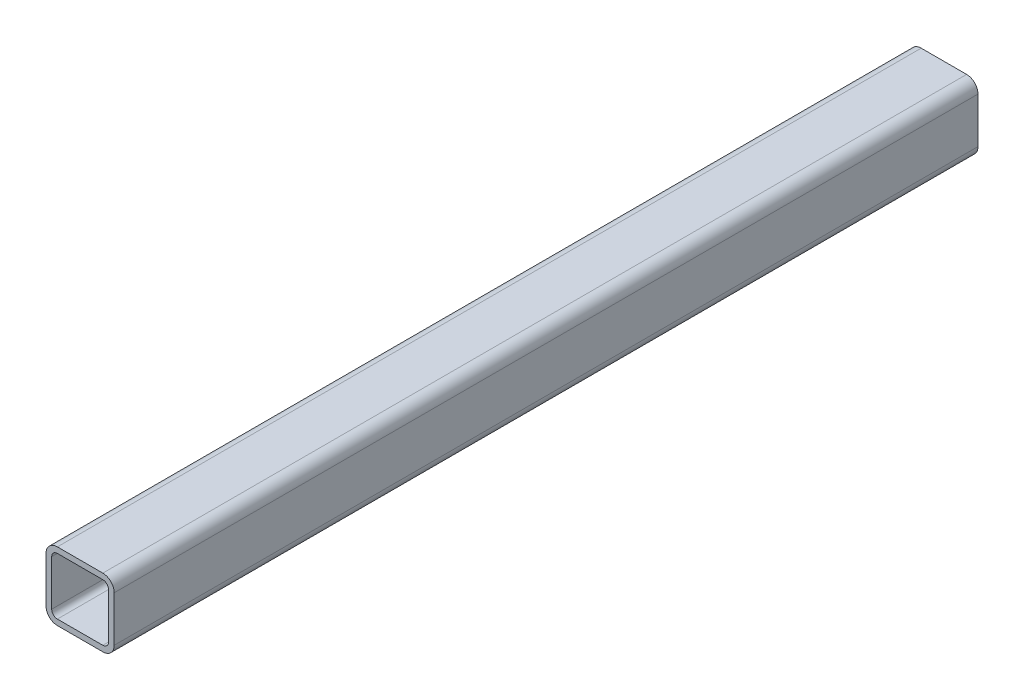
SolidWorks part; units mm, degrees
ref_plane "Plane1" through (0, 0, 0) normal (0, 0, 1) x (1, 0, 0)
ref_plane "Plane2" through (0, 0, 0) normal (0, 1, 0) x (1, 0, 0)
ref_plane "Plane3" through (0, 0, 0) normal (1, 0, 0) x (0, 0, -1)
sketch "Sketch1" plane through (0, 0, 0) normal (0, 0, 1) x (1, 0, 0)
  line L0 (-20, -25) -> (20, -25)
  line L1 (-25, -20) -> (-25, 20)
  line L2 (20, 25) -> (-20, 25)
  line L3 (25, 20) -> (25, -20)
  line L4 (-20, -30) -> (20, -30)
  line L5 (-30, -20) -> (-30, 20)
  line L6 (20, 30) -> (-20, 30)
  line L7 (30, 20) -> (30, -20)
  line L8 (-30, 0) -> (-25, 0) construction
  line L9 (-25, 0) -> (25, 0) construction
  line L10 (25, 0) -> (30, 0) construction
  line L12 (0, 30) -> (0, 25) construction
  line L13 (0, 25) -> (0, -25) construction
  line L14 (0, -25) -> (0, -30) construction
  arc A0 (30, 20) -> (20, 30) centre (20, 20) ccw
  arc A1 (20, -30) -> (30, -20) centre (20, -20) ccw
  arc A2 (-30, -20) -> (-20, -30) centre (-20, -20) ccw
  arc A3 (-20, 30) -> (-30, 20) centre (-20, 20) ccw
  arc A4 (-20, 25) -> (-25, 20) centre (-20, 20) ccw
  arc A5 (25, 20) -> (20, 25) centre (20, 20) ccw
  arc A6 (20, -25) -> (25, -20) centre (20, -20) ccw
  arc A7 (-25, -20) -> (-20, -25) centre (-20, -20) ccw
  point P2 (-30, 30)
  point P33 (-30, -30)
  point P34 (30, -30)
  point P36 (30, 30)
extrude "Extrusion1" add sketch "Sketch1" along normal blind 760
